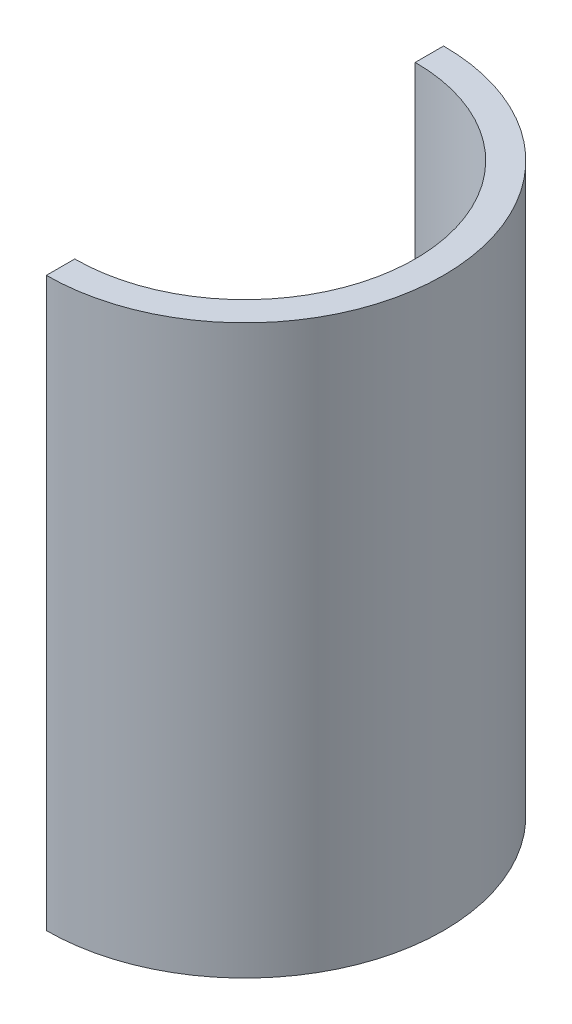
SolidWorks part; units mm, degrees
ref_plane "Front Plane" through (0, 0, 0) normal (0, 0, 1) x (1, 0, 0)
ref_plane "Top Plane" through (0, 0, 0) normal (0, 1, 0) x (1, 0, 0)
ref_plane "Right Plane" through (0, 0, 0) normal (1, 0, 0) x (0, 0, -1)
sketch "Sketch1" plane through (0, 0, 0) normal (1, 0, 0) x (0, 0, -1)
  line L0 (0, 0) -> (0, -13.0833) construction
  line L1 (15, -25) -> (17.5, -25)
  line L2 (15, -25) -> (15, 25)
  line L3 (15, 25) -> (17.5, 25)
  line L4 (17.5, -25) -> (17.5, 25)
  line L5 (15, -25) -> (17.5, 25) construction
  line L6 (15, 25) -> (17.5, -25) construction
  point P0 (16.25, 0)
  dimension "D1" = 2.5
  dimension "D2" = 50
revolve "Revolve1" add sketch "Sketch1" angle 180 about L0
